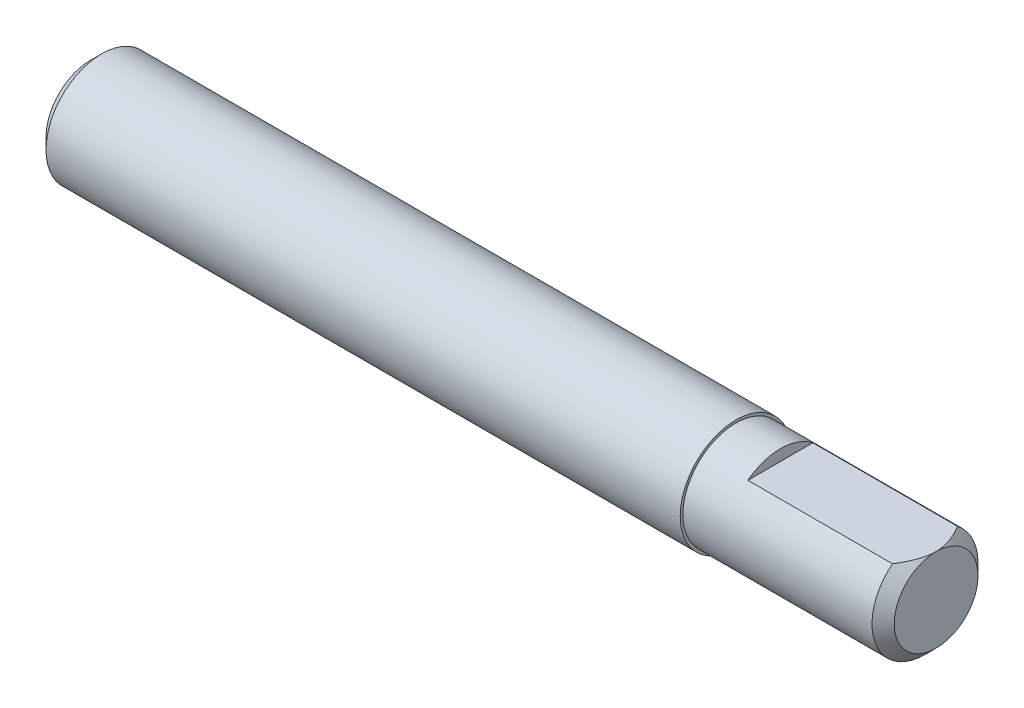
SolidWorks part; units mm, degrees
ref_plane "Front Plane" through (0, 0, 0) normal (0, 0, 1) x (1, 0, 0)
ref_plane "Top Plane" through (0, 0, 0) normal (0, 1, 0) x (1, 0, 0)
ref_plane "Right Plane" through (0, 0, 0) normal (1, 0, 0) x (0, 0, -1)
sketch "Sketch1" plane through (0, 0, 0) normal (1, 0, 0) x (0, 0, -1)
  circle A0 centre (0, 0) radius 2.5
  dimension "D1" = 5
extrude "Boss-Extrude1" add sketch "Sketch1" along normal blind 29
sketch "Sketch2" plane through (29, 0, 0) normal (1, 0, 0) x (0, 0, -1)
  circle A0 centre (0, 0) radius 2.3813
  dimension "D1" = 4.7625
extrude "Boss-Extrude2" add sketch "Sketch2" along normal blind 9
chamfer "Chamfer1" distance 0.5 angle 45 1 edges at (0, 0, -2.5)
sketch "Sketch4" plane through (0, 0, 0) normal (0, 0, 1) x (1, 0, 0)
  line L1 (38, 2.3813) -> (31, 2.3812)
  line L2 (38, 2.3813) -> (38, 1.8813)
  line L3 (38, 1.8813) -> (31, 1.8812)
  line L4 (31, 2.3812) -> (31, 1.8812)
  dimension "D1" = 7
  dimension "D2" = 0.5
extrude "Cut-Extrude1" cut sketch "Sketch4" against normal mid plane 10
chamfer "Chamfer2" distance 0.5 angle 45 1 edges at (38, -2.3813, 0)
